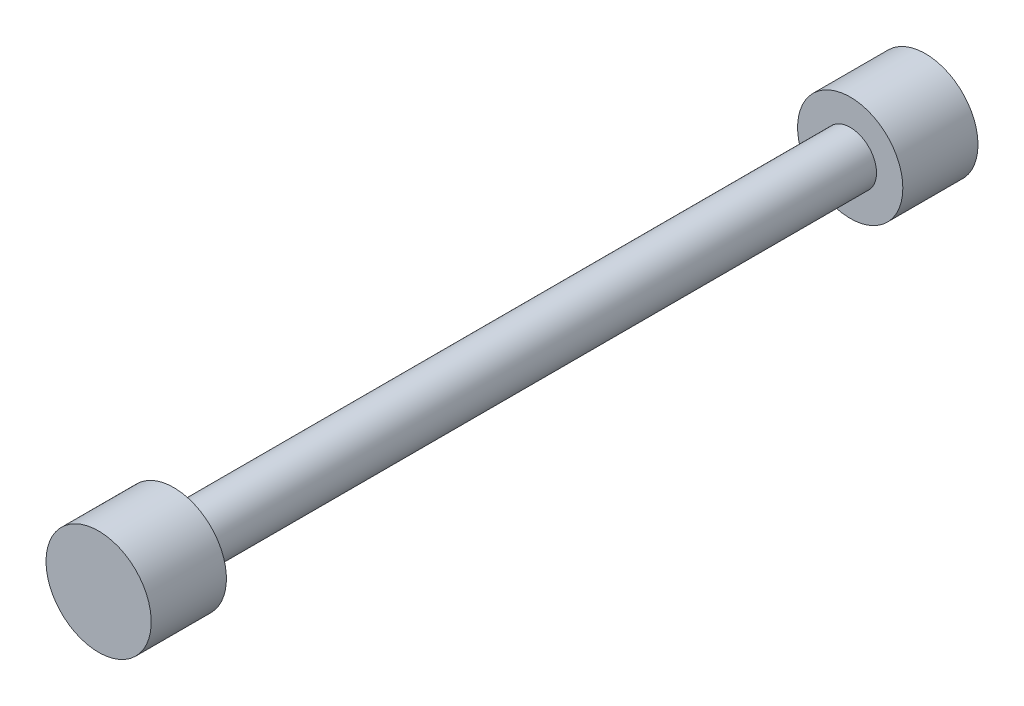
SolidWorks part; units mm, degrees
ref_plane "Plan1" through (0, 0, 0) normal (0, 0, 1) x (1, 0, 0)
ref_plane "Plan2" through (0, 0, 0) normal (0, 1, 0) x (1, 0, 0)
ref_plane "Plan3" through (0, 0, 0) normal (1, 0, 0) x (0, 0, -1)
sketch "Esquisse1" plane through (0, 0, 0) normal (0, 0, 1) x (1, 0, 0)
  circle A0 centre (0, 0) radius 3.5
  dimension "D1" = 7
extrude "Base-Extrusion" add sketch "Esquisse1" along normal blind 100
sketch "Esquisse2" plane through (0, 0, 0) normal (0, 1, 0) x (1, 0, 0)
  line L0 (0, -10) -> (0, 11.7762) construction
  line L1 (0, -5) -> (-7, -5)
  line L2 (0, -100) -> (0, 0) construction
  line L3 (-7, -5) -> (-7, 5)
  line L4 (0, -5) -> (0, 5)
  line L5 (0, 5) -> (-7, 5)
  dimension "D1" = 7
revolve "Boss.-Révol.1" add sketch "Esquisse2" angle 360 about L0
sketch "Esquisse3" plane through (0, 0, 0) normal (0, 1, 0) x (1, 0, 0)
  line L0 (0, -100) -> (0, -5) construction
  line L1 (0, -90) -> (0, -110.5206) construction
  line L2 (0, -95) -> (0, -105)
  line L3 (0, -95) -> (7, -95)
  line L4 (7, -95) -> (7, -105)
  line L5 (7, -105) -> (0, -105)
  dimension "D1" = 7
revolve "Boss.-Révol.2" add sketch "Esquisse3" angle 360 about L1
